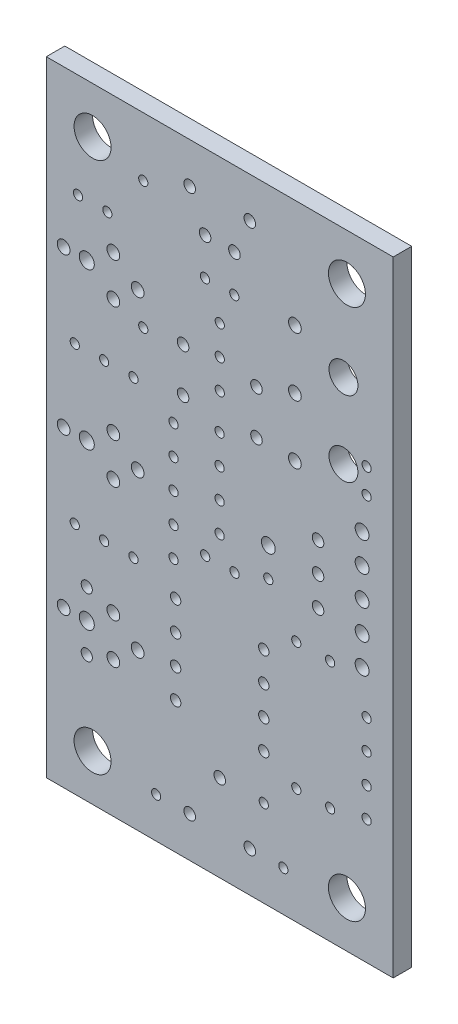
SolidWorks part; units mm, degrees
ref_plane "Plan de face" through (0, 0, 0) normal (0, 0, 1) x (1, 0, 0)
ref_plane "Plan de dessus" through (0, 0, 0) normal (0, 1, 0) x (1, 0, 0)
ref_plane "Plan de droite" through (0, 0, 0) normal (1, 0, 0) x (0, 0, -1)
sketch "Esquisse1" plane through (0, 0, 0) normal (0, 0, 1) x (1, 0, 0)
  line L0 (0, 0) -> (0, 54.0004)
  line L1 (0, 54.0004) -> (29.9999, 54.0004)
  line L2 (29.9999, 54.0004) -> (29.9999, 0)
  line L3 (29.9999, 0) -> (0, 0)
  line L4 (17.5997, 3.5001) -> (12.4003, 3.5001) construction
  line L5 (12.0481, 7.5001) -> (22.0856, 7.5001) construction
  line L6 (15, 2.3686) -> (15, 9.1286) construction
  line L7 (18.81, 9.1286) -> (18.81, 6.9367) construction
  circle A0 centre (18.1762, 38.3642) radius 0.5004
  circle A1 centre (18.1762, 34.5542) radius 0.5004
  circle A2 centre (11.8262, 34.5542) radius 0.5004
  circle A3 centre (11.8262, 38.3642) radius 0.5004
  circle A4 centre (17.5997, 3.5001) radius 0.5004
  circle A5 centre (12.4003, 3.5001) radius 0.5004
  circle A6 centre (12.4003, 50.5003) radius 0.5004
  circle A7 centre (17.5997, 50.5003) radius 0.5004
  circle A8 centre (3.5001, 10.9601) radius 0.4826
  circle A9 centre (3.5001, 16.0401) radius 0.4826
  circle A10 centre (14.9885, 30.8204) radius 0.3988
  circle A11 centre (14.9885, 33.3604) radius 0.3988
  circle A12 centre (16.2712, 47.5005) radius 0.5004
  circle A13 centre (13.7312, 47.5005) radius 0.5004
  circle A14 centre (27.7012, 13.2893) radius 0.3988
  circle A15 centre (27.7012, 10.7493) radius 0.3988
  circle A16 centre (1.4986, 13.5001) radius 0.5512
  circle A17 centre (7.8994, 13.5001) radius 0.5512
  circle A18 centre (5.7988, 11.75) radius 0.5512
  circle A19 centre (5.7988, 15.2502) radius 0.5512
  circle A20 centre (3.5001, 13.5001) radius 0.6502
  circle A21 centre (1.4986, 27.0002) radius 0.5512
  circle A22 centre (7.8994, 27.0002) radius 0.5512
  circle A23 centre (5.7988, 25.2501) radius 0.5512
  circle A24 centre (5.7988, 28.7503) radius 0.5512
  circle A25 centre (3.5001, 27.0002) radius 0.6502
  circle A26 centre (1.4986, 40.5003) radius 0.5512
  circle A27 centre (7.8994, 40.5003) radius 0.5512
  circle A28 centre (5.7988, 38.7502) radius 0.5512
  circle A29 centre (5.7988, 42.2504) radius 0.5512
  circle A30 centre (3.5001, 40.5003) radius 0.6502
  circle A31 centre (15.0012, 36.4592) radius 0.3988
  circle A32 centre (15.0012, 41.5392) radius 0.3988
  circle A33 centre (4.0005, 49.9999) radius 1.6002
  circle A34 centre (25.9994, 49.9999) radius 1.6002
  circle A35 centre (4.0005, 4.0005) radius 1.6002
  circle A36 centre (25.9994, 4.0005) radius 1.6002
  circle A37 centre (18.8062, 11.3843) radius 0.4496
  circle A38 centre (18.8062, 13.9243) radius 0.4496
  circle A39 centre (18.8062, 16.4643) radius 0.4496
  circle A40 centre (18.8062, 19.0043) radius 0.4496
  circle A41 centre (11.1862, 19.0043) radius 0.4496
  circle A42 centre (11.1862, 16.4643) radius 0.4496
  circle A43 centre (11.1862, 13.9243) radius 0.4496
  circle A44 centre (11.1862, 11.3843) radius 0.4496
  circle A45 centre (2.4613, 33.749) radius 0.3988
  circle A46 centre (5.0013, 33.749) radius 0.3988
  circle A47 centre (7.5413, 33.749) radius 0.3988
  circle A48 centre (2.4613, 20.2489) radius 0.3988
  circle A49 centre (5.0013, 20.2489) radius 0.3988
  circle A50 centre (7.5413, 20.2489) radius 0.3988
  circle A51 centre (5.2807, 45.0113) radius 0.3988
  circle A52 centre (2.7407, 45.0113) radius 0.3988
  circle A53 centre (14.9885, 28.2804) radius 0.3988
  circle A54 centre (14.9885, 25.7404) radius 0.3988
  circle A55 centre (16.2814, 23.5102) radius 0.3988
  circle A56 centre (13.7414, 23.5102) radius 0.3988
  circle A57 centre (13.7185, 44.2874) radius 0.3988
  circle A58 centre (16.2585, 44.2874) radius 0.3988
  circle A59 centre (21.4986, 44.6354) radius 0.5512
  circle A60 centre (21.4986, 39.5529) radius 0.5512
  circle A61 centre (21.4986, 34.4729) radius 0.5512
  circle A62 centre (25.6972, 42.8422) radius 1.2497
  circle A63 centre (25.6972, 36.3423) radius 1.2497
  circle A64 centre (23.5001, 29.5402) radius 0.5004
  circle A65 centre (23.5001, 27.0002) radius 0.5004
  circle A66 centre (23.5001, 24.4602) radius 0.5004
  circle A67 centre (20.5003, 3.5001) radius 0.3988
  circle A68 centre (9.4996, 3.5001) radius 0.3988
  circle A69 centre (8.3845, 48.9026) radius 0.3988
  circle A70 centre (8.3845, 37.9019) radius 0.3988
  circle A71 centre (21.6205, 10) radius 0.3988
  circle A72 centre (21.6205, 21.0007) radius 0.3988
  circle A73 centre (24.544, 10) radius 0.3988
  circle A74 centre (24.544, 21.0007) radius 0.3988
  circle A75 centre (27.7012, 15.8293) radius 0.3988
  circle A76 centre (27.7012, 37.1602) radius 0.3988
  circle A77 centre (27.7012, 18.3693) radius 0.3988
  circle A78 centre (27.7012, 35.0012) radius 0.3988
  circle A79 centre (27.3101, 27.0002) radius 0.5994
  circle A80 centre (27.3101, 29.5402) radius 0.5994
  circle A81 centre (27.3101, 32.0802) radius 0.5994
  circle A82 centre (27.3101, 24.4602) radius 0.5994
  circle A83 centre (27.3101, 21.9202) radius 0.5994
  circle A84 centre (19.1999, 27.0002) radius 0.5994
  circle A85 centre (19.1999, 24.5008) radius 0.3988
  circle A86 centre (11.0033, 32.07) radius 0.3988
  circle A87 centre (11.0033, 29.53) radius 0.3988
  circle A88 centre (11.0033, 26.99) radius 0.3988
  circle A89 centre (11.0033, 24.45) radius 0.3988
  circle A90 centre (11.0033, 21.91) radius 0.3988
  circle A91 centre (15.0012, 38.9992) radius 0.3988
  circle A111 centre (15, 7.5001) radius 0.5
  circle A112 centre (18.81, 7.5001) radius 0.4
  dimension "D1" = 3.81
  dimension "D2" = 4
extrude "Extrusion1" add sketch "Esquisse1" along normal blind 1.6
